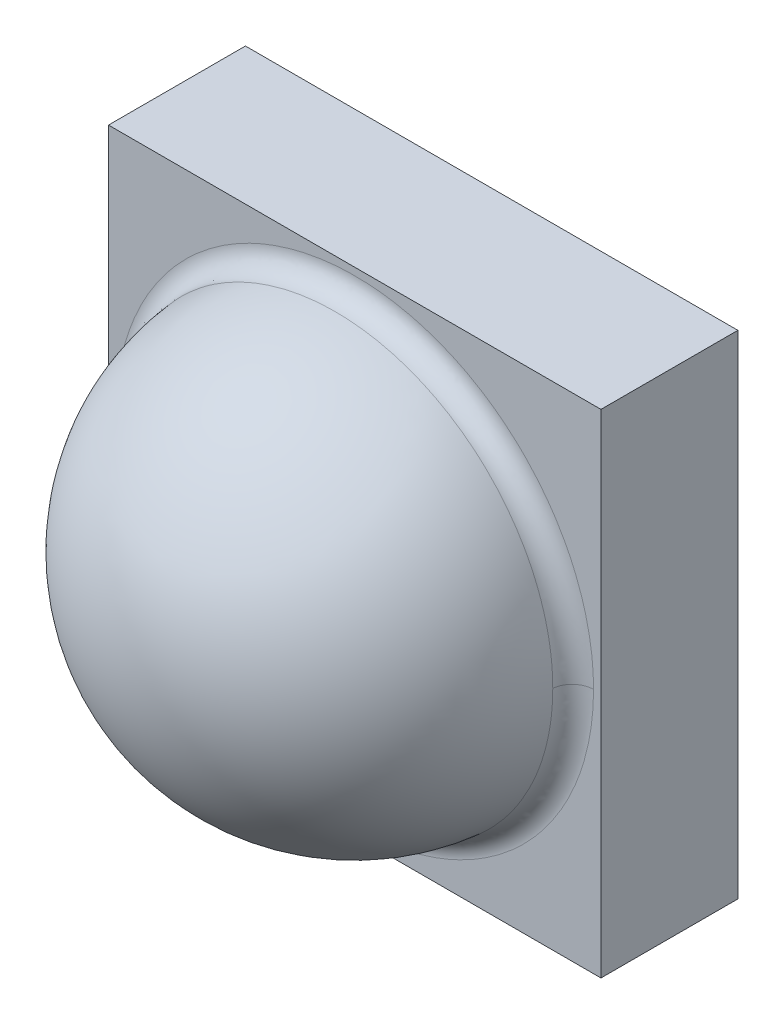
SolidWorks part; units mm, degrees
ref_plane "Front Plane" through (0, 0, 0) normal (0, 0, 1) x (1, 0, 0)
ref_plane "Top Plane" through (0, 0, 0) normal (0, 1, 0) x (1, 0, 0)
ref_plane "Right Plane" through (0, 0, 0) normal (1, 0, 0) x (0, 0, -1)
imported_body "Imported3"
sketch "Sketch1" plane through (0, 0.9834, 0) normal (0, 1, 0) x (-1, 0, 0)
  line L0 (0.4615, -0.756) -> (-0.4615, -0.756)
  line L1 (-0.4615, -0.756) -> (-0.4615, 0)
  line L2 (-0.4615, 0) -> (0.4615, 0)
  line L3 (0.4615, 0) -> (0.4615, -0.756)
extrude "Boss-Extrude1" add sketch "Sketch1" along normal blind 0.1591
sketch "Sketch2" plane through (-0.4615, 0, 0) normal (-1, 0, 0) x (0, 0, 1)
  line L0 (0, 1.1385) -> (0, 0)
  line L1 (0, 0) -> (0, -1.2248)
  line L2 (0, -1.2248) -> (-0.6811, -1.2248)
  line L3 (-0.6811, -1.2248) -> (-0.6811, -1.1425)
  line L4 (-0.6811, -1.1425) -> (-0.6931, -1.1425)
  line L5 (-0.6931, -1.1425) -> (-0.6931, 1.1385)
  line L6 (-0.6931, 1.1385) -> (0, 1.1385)
extrude "Boss-Extrude2" add sketch "Sketch2" along normal blind 0.6248
sketch "Sketch3" plane through (0.4615, 0, 0) normal (1, 0, 0) x (0, 0, -1)
  line L0 (0.6811, -1.1425) -> (0.6811, -1.2248)
  line L1 (0.6811, -1.2248) -> (0, -1.2248)
  line L2 (0, -1.2248) -> (0, 0)
  line L3 (0, 0) -> (0, 1.1385)
  line L4 (0, 1.1385) -> (0.6931, 1.1385)
  line L5 (0.6931, 1.1385) -> (0.6931, -1.1425)
  line L6 (0.6931, -1.1425) -> (0.6811, -1.1425)
extrude "Boss-Extrude3" add sketch "Sketch3" along normal blind 0.6248
sketch "Sketch4" plane through (-1.0863, 0, 0) normal (-1, 0, 0) x (0, 0, 1)
  line L0 (0, 1.1385) -> (0, -1.2248)
  line L1 (0, -1.2248) -> (-0.6811, -1.2248)
  line L2 (-0.6811, -1.2248) -> (-0.6811, -1.1425)
  line L3 (-0.6811, -1.1425) -> (-0.6931, -1.1425)
  line L4 (-0.6931, -1.1425) -> (-0.6931, 1.1385)
  line L5 (-0.6931, 1.1385) -> (0, 1.1385)
extrude "Boss-Extrude4" add sketch "Sketch4" along normal blind 0.1384
sketch "Sketch5" plane through (1.0863, 0, 0) normal (1, 0, 0) x (0, 0, -1)
  line L0 (0.6811, -1.1425) -> (0.6811, -1.2248)
  line L1 (0.6811, -1.2248) -> (0, -1.2248)
  line L2 (0, -1.2248) -> (0, 1.1385)
  line L3 (0, 1.1385) -> (0.6931, 1.1385)
  line L4 (0.6931, 1.1385) -> (0.6931, -1.1425)
  line L5 (0.6931, -1.1425) -> (0.6811, -1.1425)
extrude "Boss-Extrude5" add sketch "Sketch5" along normal blind 0.1384
sketch "Sketch6" plane through (-1.2248, 0, 0) normal (-1, 0, 0) x (0, 0, 1)
  line L0 (-0.6931, -1.1425) -> (-0.6811, -1.1425)
  line L1 (-0.6811, -1.1425) -> (-0.6811, 1.0863)
  line L2 (-0.6811, 1.0863) -> (0, 1.0863)
  line L3 (0, 1.0863) -> (0, 1.1385)
  line L4 (0, 1.1385) -> (-0.6931, 1.1385)
  line L5 (-0.6931, 1.1385) -> (-0.6931, -1.1425)
extrude "Cut-Extrude1" cut sketch "Sketch6" against normal blind 0.4082
sketch "Sketch7" plane through (1.2248, 0, 0) normal (1, 0, 0) x (0, 0, -1)
  line L0 (0.6931, -1.1425) -> (0.6931, 1.1385)
  line L1 (0.6931, 1.1385) -> (0, 1.1385)
  line L2 (0, 1.1385) -> (0, 1.0863)
  line L3 (0, 1.0863) -> (0.6811, 1.0863)
  line L4 (0.6811, 1.0863) -> (0.6811, -1.1425)
  line L5 (0.6811, -1.1425) -> (0.6931, -1.1425)
extrude "Cut-Extrude2" cut sketch "Sketch7" against normal blind 0.4082
sketch "Sketch8" plane through (0, 0, 0) normal (0, 0, 1) x (1, 0, 0)
  line L0 (0.8165, 1.1385) -> (0.4615, 1.1385)
  line L1 (0.4615, 1.1385) -> (0.4615, 1.1425)
  line L2 (0.4615, 1.1425) -> (-0.4615, 1.1425)
  line L3 (-0.4615, 1.1425) -> (-0.4615, 1.1385)
  line L4 (-0.4615, 1.1385) -> (-0.8165, 1.1385)
  line L5 (-0.8165, 1.1385) -> (-0.8165, 1.0863)
  line L6 (-0.8165, 1.0863) -> (0.8165, 1.0863)
  line L7 (0.8165, 1.0863) -> (0.8165, 1.1385)
extrude "Cut-Extrude3" cut sketch "Sketch8" against normal blind 0.6811
sketch "Sketch9" plane through (0, 1.0863, 0) normal (0, 1, 0) x (-1, 0, 0)
  line L0 (1.2248, 0) -> (1.2248, -0.6811)
  line L1 (1.2248, -0.6811) -> (-1.2248, -0.6811)
  line L2 (-1.2248, -0.6811) -> (-1.2248, 0)
  line L3 (-1.2248, 0) -> (1.2248, 0)
extrude "Boss-Extrude6" add sketch "Sketch9" along normal blind 0.1384
sketch "Sketch10" plane through (-0.8165, 0, 0) normal (-1, 0, 0) x (0, 0, 1)
  line L0 (-0.756, -1.1425) -> (-0.756, 1.1425)
  line L1 (-0.756, 1.1425) -> (-0.6811, 1.1425)
  line L2 (-0.6811, 1.1425) -> (-0.6811, -1.1425)
  line L3 (-0.6811, -1.1425) -> (-0.756, -1.1425)
extrude "Boss-Extrude7" add sketch "Sketch10" along normal blind 0.326
sketch "Sketch11" plane through (0.8165, 0, 0) normal (1, 0, 0) x (0, 0, -1)
  line L0 (0.6811, 1.1425) -> (0.756, 1.1425)
  line L1 (0.756, 1.1425) -> (0.756, -1.1425)
  line L2 (0.756, -1.1425) -> (0.6811, -1.1425)
  line L3 (0.6811, -1.1425) -> (0.6811, 1.1425)
extrude "Boss-Extrude8" add sketch "Sketch11" along normal blind 0.326
sketch "Sketch12" plane through (0, 0, -0.756) normal (0, 0, -1) x (-1, 0, 0)
  circle A0 centre (0.9763, -0.71) radius 0.06
extrude "Cut-Extrude4" cut sketch "Sketch12" against normal blind 0.075
sketch "Sketch13" plane through (0, 0, -0.6811) normal (0, 0, -1) x (-1, 0, 0)
  circle A0 centre (0.9763, -0.71) radius 0.06
extrude "Cut-Extrude5" cut sketch "Sketch13" against normal blind 0.5 draft 2.062
sketch "Sketch14" plane through (0, 0, -0.756) normal (0, 0, -1) x (-1, 0, 0)
  circle A0 centre (0.9763, 0.71) radius 0.06
extrude "Cut-Extrude6" cut sketch "Sketch14" against normal blind 0.075
sketch "Sketch15" plane through (0, 0, -0.6811) normal (0, 0, -1) x (-1, 0, 0)
  circle A0 centre (0.9763, 0.71) radius 0.06
extrude "Cut-Extrude7" cut sketch "Sketch15" against normal blind 0.5 draft 2.062
sketch "Sketch16" plane through (0, 0, -0.756) normal (0, 0, -1) x (-1, 0, 0)
  circle A0 centre (-0.9763, 0.71) radius 0.06
extrude "Cut-Extrude8" cut sketch "Sketch16" against normal blind 0.075
sketch "Sketch17" plane through (0, 0, -0.6811) normal (0, 0, -1) x (-1, 0, 0)
  circle A0 centre (-0.9763, 0.71) radius 0.06
extrude "Cut-Extrude9" cut sketch "Sketch17" against normal blind 0.5 draft 2.062
sketch "Sketch18" plane through (0, 0, -0.756) normal (0, 0, -1) x (-1, 0, 0)
  circle A0 centre (-0.9763, -0.71) radius 0.06
extrude "Cut-Extrude10" cut sketch "Sketch18" against normal blind 0.075
sketch "Sketch19" plane through (0, 0, -0.6811) normal (0, 0, -1) x (-1, 0, 0)
  circle A0 centre (-0.9763, -0.71) radius 0.06
extrude "Cut-Extrude11" cut sketch "Sketch19" against normal blind 0.5 draft 2.062
fillet "Fillet1" radius 0.1065 2 edges at (0, -1.0863, 0) (0, 1.0863, 0)
